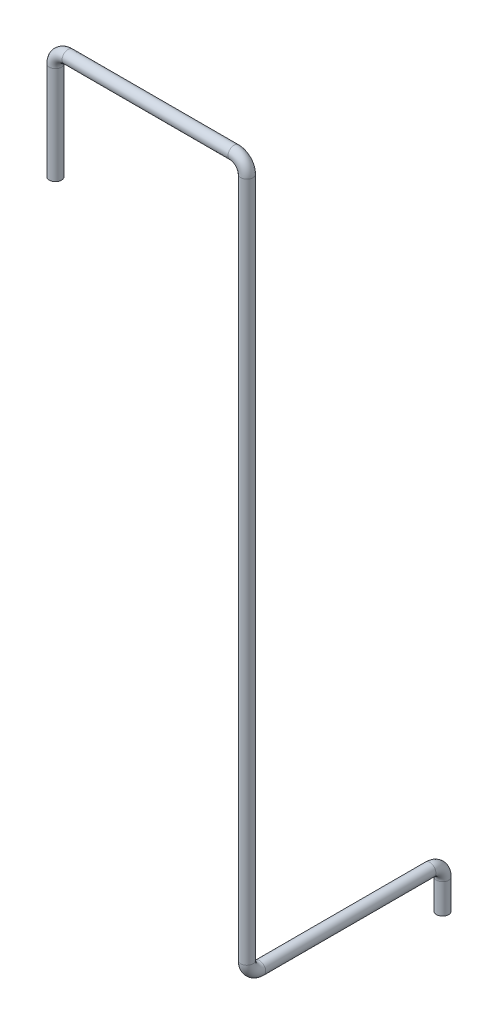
SolidWorks part; units mm, degrees
ref_plane "Alzado" through (0, 0, 0) normal (0, 0, 1) x (1, 0, 0)
ref_plane "Planta" through (0, 0, 0) normal (0, 1, 0) x (1, 0, 0)
ref_plane "Vista lateral" through (0, 0, 0) normal (1, 0, 0) x (0, 0, -1)
sketch3d "Croquis3D4"
  line L0 (0, 0, 0) -> (0, 70, 0)
  line L1 (0, 100, 30) -> (0, 100, 430)
  line L2 (0, 130, 460) -> (0, 1730, 460)
  line L3 (-30, 1760, 460) -> (-420, 1760, 460)
  line L4 (-450, 1730, 460) -> (-450, 1500, 460)
  arc A0 (0, 70, 0) -> (0, 100, 30) centre (0, 70, 30) ccw
  arc A1 (0, 100, 430) -> (0, 130, 460) centre (0, 130, 430) ccw
  arc A2 (0, 1730, 460) -> (-30, 1760, 460) centre (-30, 1730, 460) ccw
  arc A3 (-420, 1760, 460) -> (-450, 1730, 460) centre (-420, 1730, 460) ccw
  point P9 (0, 100, 0)
  point P10 (30, 70, 30)
  point P13 (0, 100, 460)
  point P14 (-30, 130, 430)
  point P17 (0, 1760, 460)
  point P18 (-30, 1730, 490)
  point P21 (-450, 1760, 460)
  point P22 (-420, 1730, 490)
  dimension "D6" = 30
  dimension "D1" = 100
  dimension "D2" = 460
  dimension "D3" = 1660
  dimension "D4" = 450
  dimension "D5" = 260
sketch "Croquis1" plane through (0, 0, 0) normal (0, 1, 0) x (1, 0, 0)
  circle A0 centre (0, 0) radius 14.3
  circle A1 centre (0, 0) radius 12.7
  dimension "D1" = 28.6
  dimension "D2" = 25.4
sweep "Barrer1" add profiles "Croquis1" path "Croquis3D4"
ref_plane "Plano1" through (0, 0, 0) normal (0, 0, 1) x (1, 0, 0)
